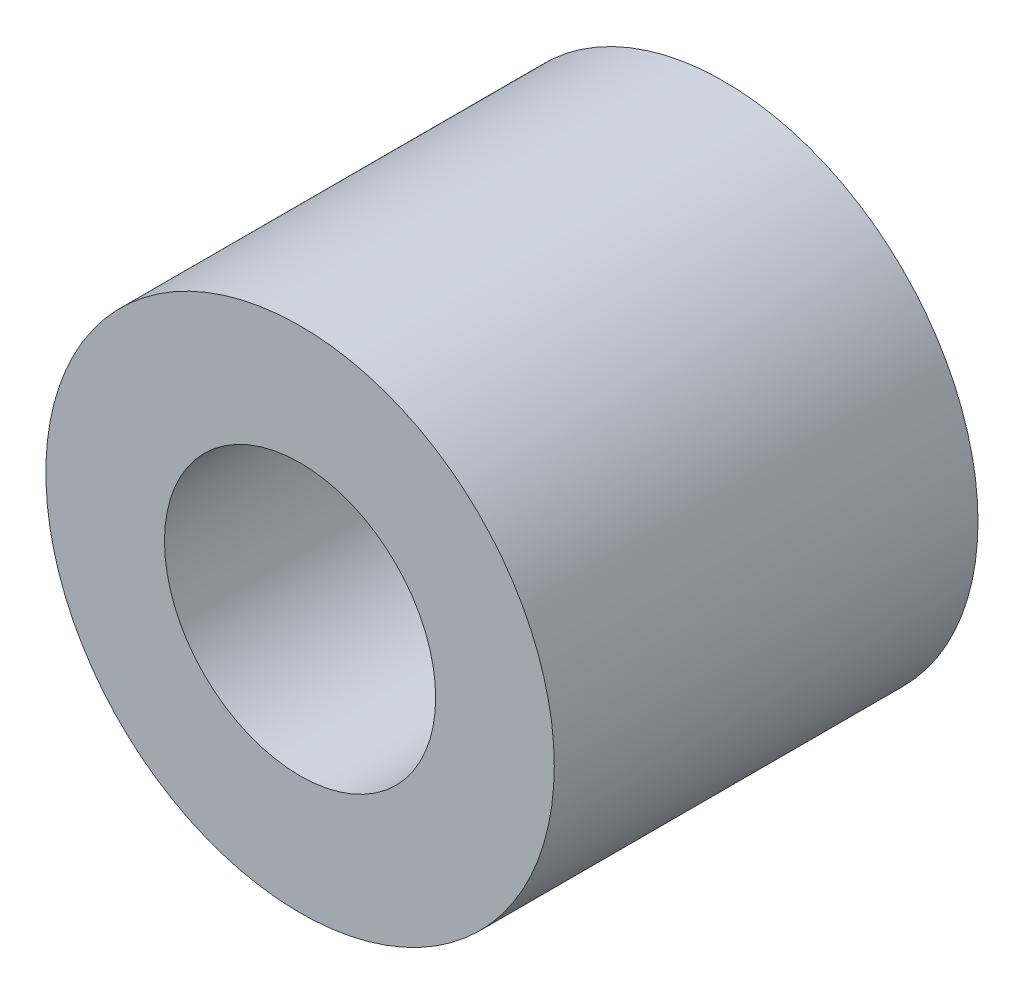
SolidWorks part; units mm, degrees
ref_plane "Plan de face" through (0, 0, 0) normal (0, 0, 1) x (1, 0, 0)
ref_plane "Plan de dessus" through (0, 0, 0) normal (0, 1, 0) x (1, 0, 0)
ref_plane "Plan de droite" through (0, 0, 0) normal (1, 0, 0) x (0, 0, -1)
sketch "Esquisse1" plane through (0, 0, 0) normal (0, 0, 1) x (1, 0, 0)
  circle A0 centre (0, 0) radius 1.6
  circle A1 centre (0, 0) radius 3
extrude "Boss.-Extru.1" add sketch "Esquisse1" along normal blind 5
